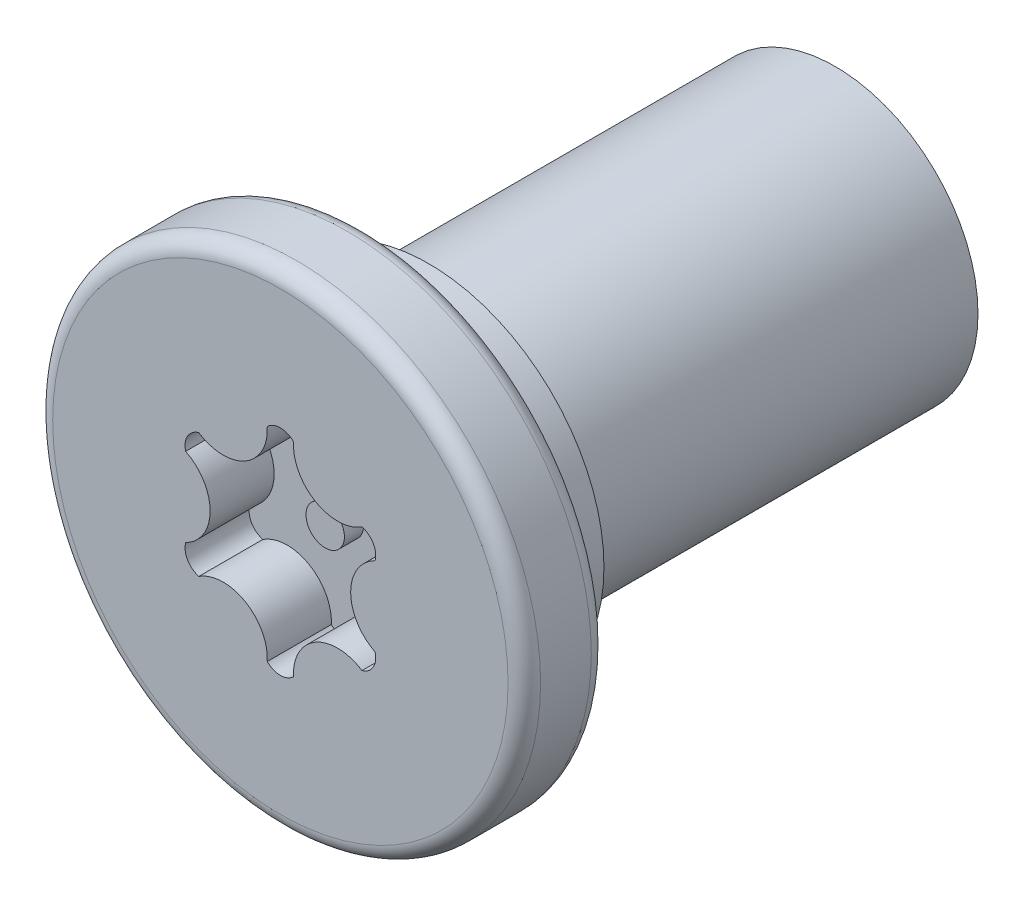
SolidWorks part; units mm, degrees
ref_plane "Front Plane" through (0, 0, 0) normal (0, 0, 1) x (1, 0, 0)
ref_plane "Top Plane" through (0, 0, 0) normal (0, 1, 0) x (1, 0, 0)
ref_plane "Right Plane" through (0, 0, 0) normal (1, 0, 0) x (0, 0, -1)
sketch "Sketch2" plane through (0, 0, 0) normal (1, 0, 0) x (0, 0, -1)
  line L1 (0, 0) -> (1.3, 0)
  line L2 (0, 0) -> (0, 3.81)
  line L3 (0, 3.81) -> (1.3, 3.81)
  line L4 (1.3, 0) -> (1.3, 3.81)
  line L5 (1.3, 0) -> (14, 0)
  line L6 (1.3, 0) -> (1.3, 2.23)
  line L7 (1.3, 2.23) -> (14, 2.23)
  line L8 (14, 0) -> (14, 2.23)
  dimension "D1" = 3.81
  dimension "D2" = 1.3
  dimension "D3" = 12.7
  dimension "D4" = 2.23
revolve "Revolve1" add sketch "Sketch2" angle 360 about L5
sketch "Sketch3" plane through (0, 0, 0) normal (0, 0, 1) x (1, 0, 0)
  line L0 (0, 1.3843) -> (0, 0)
  line L3 (1.1845, -1.0048) -> (2.4257, -1.0048)
  line L4 (0, 1.675) -> (0, 1.6727)
  line L5 (0, 1.675) -> (0, 1.6727)
  line L6 (0, 1.6727) -> (0, 1.675)
  line L8 (1.0407, 1.8026) -> (1.1012, 1.9073)
  line L9 (1.3857, 1.205) -> (2.5818, 1.205)
  line L10 (0, 0) -> (0.8375, 1.4506)
  line L11 (0, 0) -> (2.5818, 0)
  line L14 (2.5818, 0) -> (2.5818, 1.205)
  line L15 (1.3857, 1.205) -> (-0.1691, 1.205)
  circle A0 centre (0, 0) radius 1.675
  arc A7 (1.1845, -1.0048) -> (1.0345, -1.0748) centre (0.8546, -0.4934) cw
  arc A16 (-0.2051, 1.5894) -> (0.2051, 1.5894) centre (0, 1.3843) cw
  arc A18 (0.2051, 1.5894) -> (1.2739, 0.9723) centre (0.8938, 1.5482) ccw
  arc A19 (1.479, 0.6171) -> (1.479, -0.6171) centre (1.7877, 0) ccw
  arc A20 (1.2739, 0.9723) -> (1.479, 0.6171) centre (1.1988, 0.6922) cw
  arc A21 (1.2739, -0.9723) -> (0.2051, -1.5894) centre (0.8938, -1.5482) ccw
  arc A22 (1.479, -0.6171) -> (1.2739, -0.9723) centre (1.1988, -0.6922) cw
  arc A23 (-0.2051, -1.5894) -> (-1.2739, -0.9723) centre (-0.8938, -1.5482) ccw
  arc A24 (0.2051, -1.5894) -> (-0.2051, -1.5894) centre (0, -1.3843) cw
  arc A25 (-1.479, -0.6171) -> (-1.479, 0.6171) centre (-1.7877, 0) ccw
  arc A26 (-1.2739, -0.9723) -> (-1.479, -0.6171) centre (-1.1988, -0.6922) cw
  arc A27 (-1.2739, 0.9723) -> (-0.2051, 1.5894) centre (-0.8938, 1.5482) ccw
  arc A28 (-1.479, 0.6171) -> (-1.2739, 0.9723) centre (-1.1988, 0.6922) cw
  point P38 (0, 0)
  point P52 (0, 0)
  dimension "D1" = 3.35
  dimension "D4" = 1.205
  dimension "D2" = 6
  dimension "D5" = 60
extrude "Cut-Extrude3" cut sketch "Sketch3" against normal blind 1
fillet "Fillet12" radius 0.254 2 edges at (3.81, 0, 0) (3.81, 0, -1.3)
sketch "Sketch7" plane through (0, 0, -14) normal (0, 0, -1) x (-1, 0, 0)
  circle A0 centre (0, 0) radius 2.23
  dimension "D1" = 4.46
extrude "Cut-Extrude6" cut sketch "Sketch7" against normal blind 12.7
sketch "Sketch11" plane through (0, 0, -1.3) normal (0, 0, -1) x (-1, 0, 0)
  circle A0 centre (0, 0) radius 2.23
  circle A1 centre (0, 0) radius 2.738
extrude "Boss-Extrude1" add sketch "Sketch11" along normal blind 1.016
sketch "Sketch12" plane through (0, 0, -1.3) normal (0, 0, -1) x (-1, 0, 0)
  circle A0 centre (0, 0) radius 2.23
extrude "Boss-Extrude2" add sketch "Sketch12" along normal blind 12.7
sketch "Sketch14" plane through (0, 0, -1) normal (0, 0, 1) x (1, 0, 0)
  circle A0 centre (0, 0) radius 0.3
extrude "Boss-Extrude4" add sketch "Sketch14" along normal blind 0.3
sketch "Sketch15" plane through (0, 0, -14) normal (0, 0, -1) x (-1, 0, 0)
  circle A0 centre (0, 0) radius 2.23
extrude "Cut-Extrude7" cut sketch "Sketch15" against normal blind 12.7
sketch "Sketch16" plane through (0, 0, -1.3) normal (0, 0, -1) x (-1, 0, 0)
  circle A0 centre (0, 0) radius 2.23
extrude "Boss-Extrude5" add sketch "Sketch16" along normal blind 7.366
